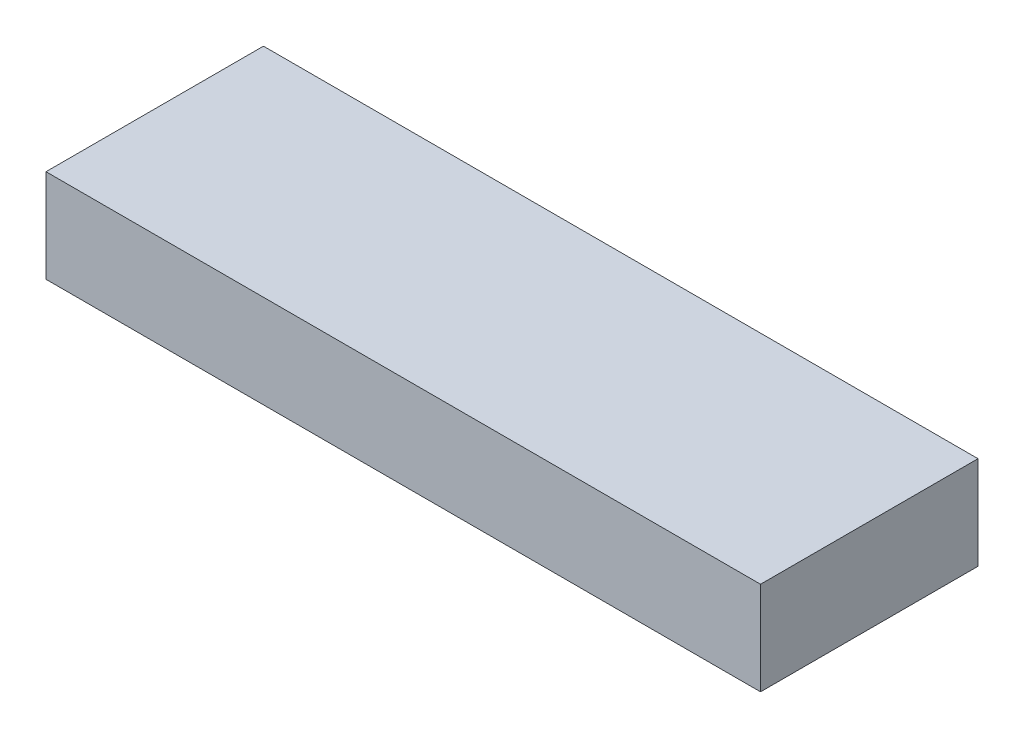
SolidWorks part; units mm, degrees
ref_plane "Front Plane" through (0, 0, 0) normal (0, 0, 1) x (1, 0, 0)
ref_plane "Top Plane" through (0, 0, 0) normal (0, 1, 0) x (1, 0, 0)
ref_plane "Right Plane" through (0, 0, 0) normal (1, 0, 0) x (0, 0, -1)
sketch "Sketch1" plane through (0, 0, 0) normal (1, 0, 0) x (0, 0, -1)
  line L1 (0, 0) -> (88.9, 0)
  line L2 (0, 0) -> (0, 38.1)
  line L3 (0, 38.1) -> (88.9, 38.1)
  line L4 (88.9, 0) -> (88.9, 38.1)
  dimension "D1" = 88.9
  dimension "D2" = 38.1
extrude "Boss-Extrude1" add sketch "Sketch1" along normal blind 292.1
